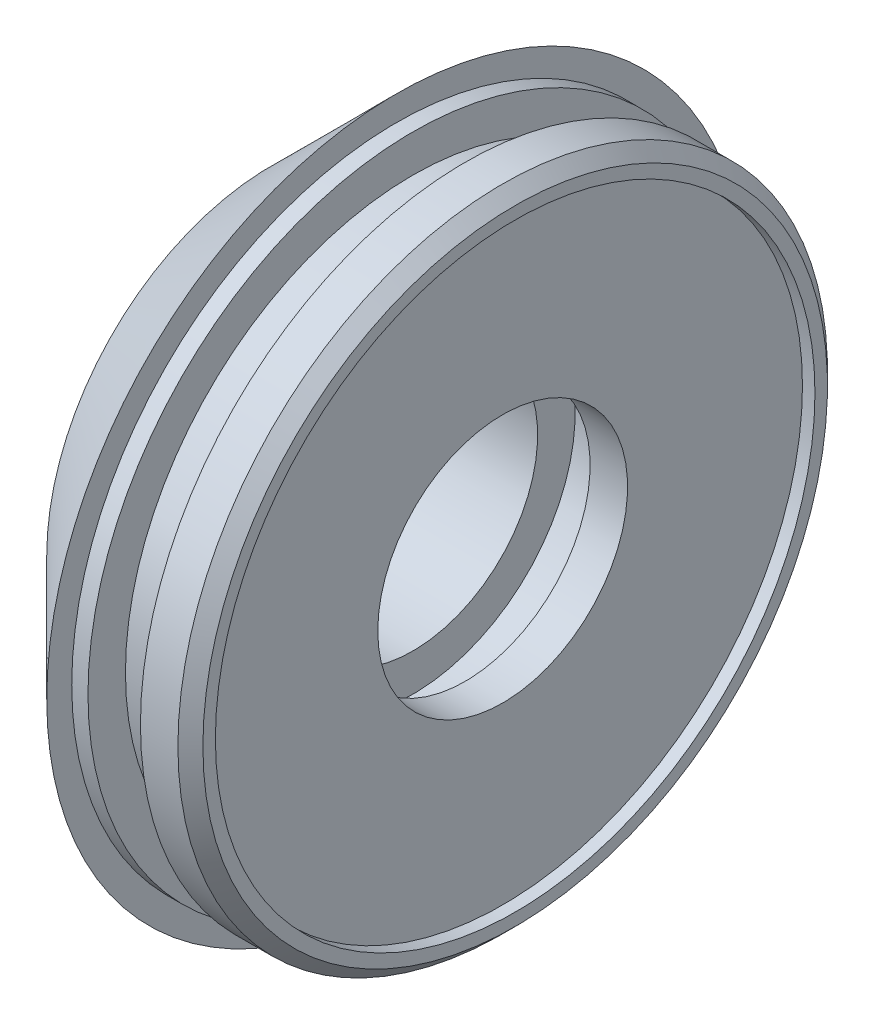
SolidWorks part; units mm, degrees
ref_plane "Plan1" through (0, 0, 0) normal (0, 0, 1) x (1, 0, 0)
ref_plane "Plan2" through (0, 0, 0) normal (0, 1, 0) x (1, 0, 0)
ref_plane "Plan3" through (0, 0, 0) normal (1, 0, 0) x (0, 0, -1)
sketch "Esquisse1" plane through (0, 0, 0) normal (0, 0, 1) x (1, 0, 0)
  line L0 (0, 5) -> (0, 9)
  line L1 (0, 9) -> (5, 14)
  line L2 (5, 14) -> (5, 13)
  line L3 (5, 13) -> (5.65, 13)
  line L4 (5.65, 13) -> (5.65, 11.5)
  line L5 (9.75, 12.5) -> (9.75, 12)
  line L6 (9.25, 5) -> (7.75, 5)
  line L7 (5.65, 11.5) -> (7.75, 11.5)
  line L8 (7.75, 11.5) -> (7.75, 13)
  line L9 (-30, 0) -> (90, 0) construction
  line L10 (7.75, 13) -> (9.25, 13)
  line L11 (9.25, 13) -> (9.75, 12.5)
  line L12 (5.65, 5) -> (5.65, 6.5)
  line L13 (5.65, 6.5) -> (7.75, 6.5)
  line L14 (7.75, 6.5) -> (7.75, 5)
  line L15 (5.65, 5) -> (0, 5)
  line L16 (9.75, 12) -> (9.25, 12)
  line L17 (9.25, 12) -> (9.25, 5)
  dimension "D1" = 5
  dimension "D2" = 2.1
  dimension "D3" = 0.5
  dimension "D4" = 13
  dimension "D5" = 135
  dimension "D6" = 5
  dimension "D7" = 135
  dimension "D8" = 2
  dimension "D9" = 9.75
  dimension "D10" = 14
  dimension "D11" = 1.5
  dimension "D12" = 1.5
  dimension "D13" = 2.1
  dimension "D14" = 0.5
  dimension "D15" = 12
revolve "Base-Révolution" add sketch "Esquisse1" angle 360 about L9
